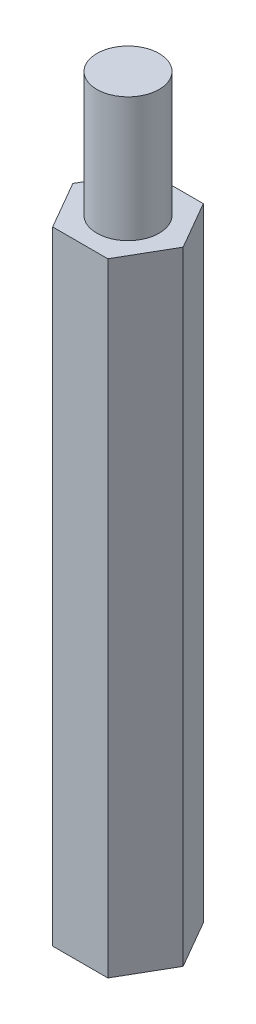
SolidWorks part; units mm, degrees
ref_plane "前视基准面" through (0, 0, 0) normal (0, 0, 1) x (1, 0, 0)
ref_plane "上视基准面" through (0, 0, 0) normal (0, 1, 0) x (1, 0, 0)
ref_plane "右视基准面" through (0, 0, 0) normal (1, 0, 0) x (0, 0, -1)
other "Configuration Table"
sketch "草图1" plane through (0, 0, 0) normal (0, 1, 0) x (1, 0, 0)
  line L1 (2.6558, 0) -> (1.3279, 2.3)
  line L2 (1.3279, 2.3) -> (-1.3279, 2.3)
  line L3 (-1.3279, 2.3) -> (-2.6558, 0)
  line L4 (-2.6558, 0) -> (-1.3279, -2.3)
  line L5 (-1.3279, -2.3) -> (1.3279, -2.3)
  line L6 (1.3279, -2.3) -> (2.6558, 0)
  circle A0 centre (0, 0) radius 2.3 construction
  dimension "D1" = 4.6
extrude "凸台-拉伸1" add sketch "草图1" along normal blind 30
sketch "草图2" plane through (0, 30, 0) normal (0, 1, 0) x (1, 0, 0)
  circle A0 centre (0, 0) radius 1.5
  dimension "D1" = 3
extrude "凸台-拉伸2" add sketch "草图2" along normal blind 6
sketch "草图3" plane through (0, 0, 0) normal (0, -1, 0) x (1, 0, 0)
  circle A0 centre (0, 0) radius 1.5
  dimension "D1" = 3
extrude "切除-拉伸1" cut sketch "草图3" against normal blind 10
